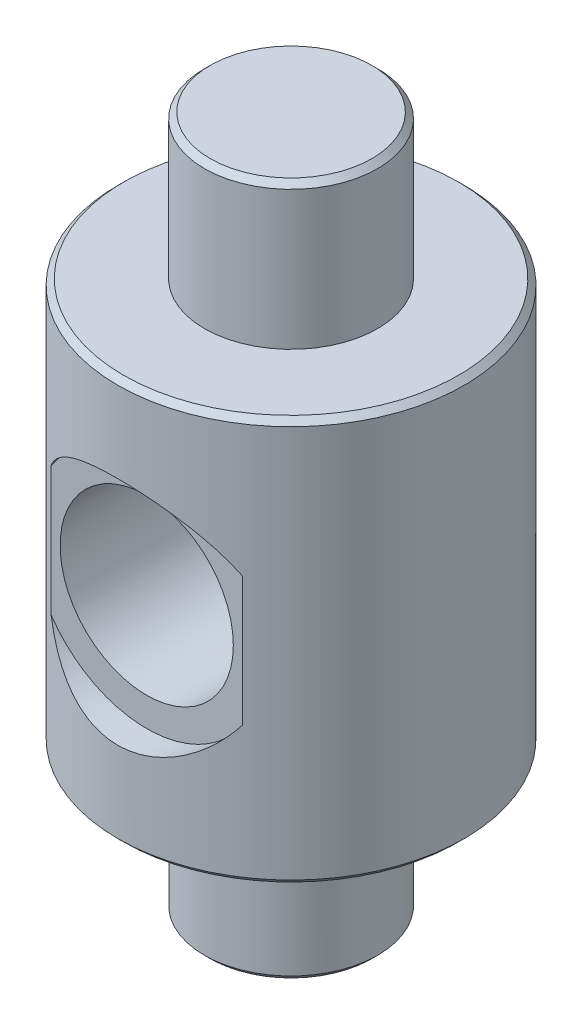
SolidWorks part; units mm, degrees
ref_plane "Front Plane" through (0, 0, 0) normal (0, 0, 1) x (1, 0, 0)
ref_plane "Top Plane" through (0, 0, 0) normal (0, 1, 0) x (1, 0, 0)
ref_plane "Right Plane" through (0, 0, 0) normal (1, 0, 0) x (0, 0, -1)
sketch "Sketch1" plane through (0, 0, 0) normal (0, 0, 1) x (1, 0, 0)
  line L0 (0, 0) -> (0, -7245.3673) construction
  line L1 (0, 0) -> (7245.3673, 0) construction
  line L2 (0, 12) -> (-1.5, 12)
  line L3 (-1.5, 12) -> (-1.5, 9.5)
  line L4 (-1.5, 9.5) -> (-3, 9.5)
  line L5 (0, 12) -> (0, 0)
  line L9 (-3, 9.5) -> (-3, 2.5)
  line L10 (-3, 2.5) -> (-1.5, 2.5)
  line L11 (-1.5, 2.5) -> (-1.5, 0)
  line L12 (-1.5, 0) -> (0, 0)
  dimension "D1" = 2.5
  dimension "D2" = 2.5
  dimension "D3" = 3
  dimension "D4" = 3
  dimension "D5" = 7
  dimension "D6" = 6
revolve "Revolve2" add sketch "Sketch1" angle 360 about L0
ref_plane "Plane1" through (0, 0, 3) normal (0, 0, 1) x (1, 0, 0)
sketch "Sketch4" plane through (0, 0, 3) normal (0, 0, 1) x (1, 0, 0)
  circle A0 centre (0, 6) radius 2
  dimension "D1" = 4
  dimension "D2" = 6
extrude "Cut-Extrude1" cut sketch "Sketch4" against normal blind 0.5
mirror "Mirror1" about plane through (0, 0, 0) normal (0, 0, 1) of "Cut-Extrude1"
sketch "Sketch5" plane through (0, 0, 2.5) normal (0, 0, 1) x (1, 0, 0)
  circle A0 centre (0, 6) radius 1.5
  point P2 (0, 0)
  point P3 (0, 6)
  dimension "D1" = 3
  dimension "D2" = 6
extrude "Cut-Extrude2" cut sketch "Sketch5" against normal through all
chamfer "Chamfer1" distance 0.1 angle 45 4 edges at (0, 0, 1.5) (0, 2.5, 3) (0, 9.5, 3) (0, 12, 1.5)
